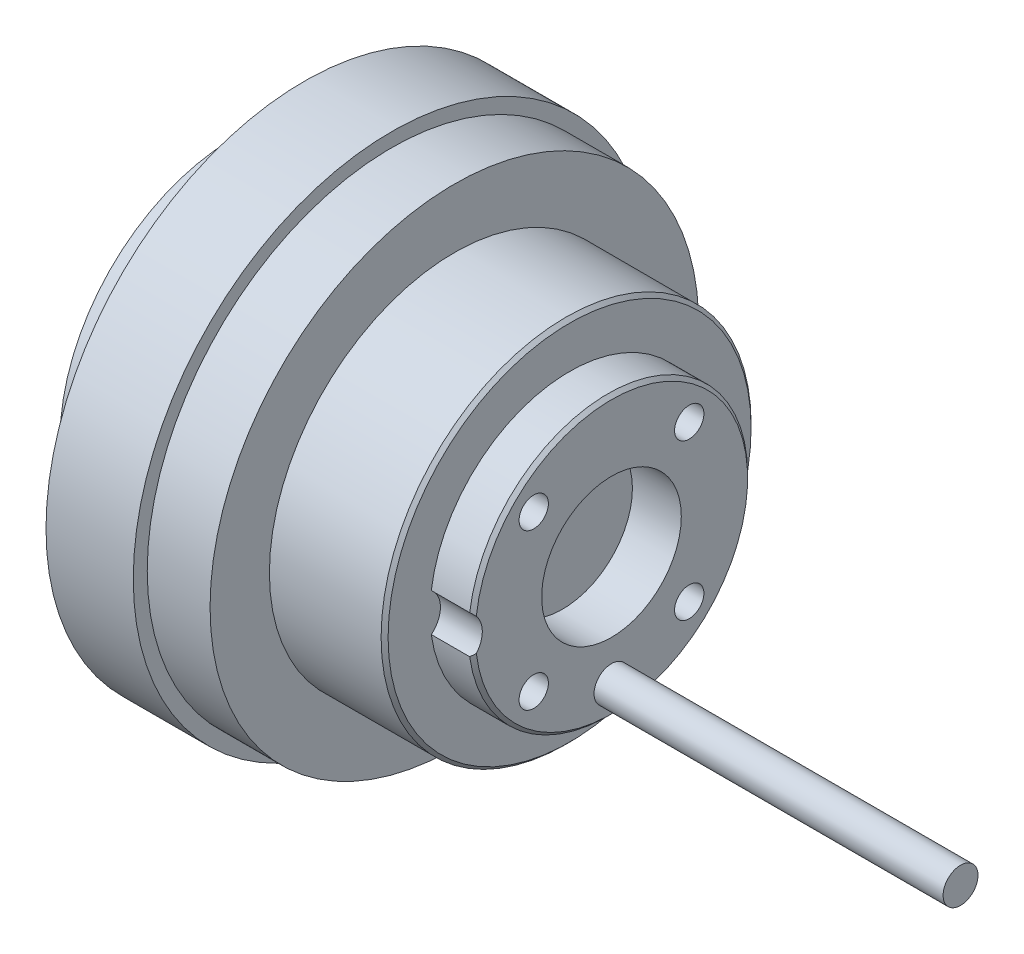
SolidWorks part; units mm, degrees
ref_plane "Front Plane" through (0, 0, 0) normal (0, 0, 1) x (1, 0, 0)
ref_plane "Top  Plane" through (0, 0, 0) normal (0, 1, 0) x (1, 0, 0)
ref_plane "Right  Plane" through (0, 0, 0) normal (1, 0, 0) x (0, 0, -1)
sketch "Sketch2" plane through (0, 0, 0) normal (0, 0, 1) x (1, 0, 0)
  circle A0 centre (0, 0) radius 38
  dimension "D1" = 76
extrude "Base-Extrude" add sketch "Sketch2" along normal mid plane 80
sketch "Sketch3" plane through (0, 0, 0) normal (0, 0, 1) x (1, 0, 0)
  line L0 (46, 40) -> (46, -40)
  line L1 (-75, 16.4833) -> (-75, -26.4833)
  line L2 (0, 0) -> (46, 0) construction
  line L3 (46, 40) -> (39, 40)
  line L4 (46, -40) -> (39, -40)
  line L5 (39, 40) -> (0, 44)
  line L6 (0, 44) -> (-57, 44)
  line L7 (39, -40) -> (0, -54)
  line L8 (0, -54) -> (-57, -54)
  line L9 (-57, 44) -> (-57, -54) construction
  line L10 (-61.3301, -51.5) -> (-74.3301, -28.9833)
  line L11 (-61.3301, 41.5) -> (-74.3301, 18.9833)
  circle A0 centre (0, 0) radius 38 construction
  arc A1 (-57, -54) -> (-61.3301, -51.5) centre (-57, -49) cw
  arc A2 (-57, 44) -> (-61.3301, 41.5) centre (-57, 39) ccw
  arc A3 (-75, -26.4833) -> (-74.3301, -28.9833) centre (-70, -26.4833) ccw
  arc A4 (-74.3301, 18.9833) -> (-75, 16.4833) centre (-70, 16.4833) ccw
  dimension "D4" = 46
  dimension "D7" = 5
  dimension "D10" = 5
  dimension "D1" = 80
  dimension "D2" = 4
  dimension "D3" = 14
  dimension "D5" = 121
  dimension "D6" = 18
  dimension "D8" = 30
  dimension "D9" = 30
  dimension "D11" = 7
extrude "Boss-Extrude1" add sketch "Sketch3" along normal mid plane 68
fillet "Fillet7" radius 2 2 edges at (38, 0, 34) (38, 0, -34)
fillet "Fillet9" radius 4 24 edges at (19.5, 42, -34) (-28.5, 44, -34) (-59.5, 43.3301, -34) (-67.8301, 30.2417, -34) (-74.8296, 17.7774, -34) (-75, -5, -34) (-74.8296, -27.7774, -34) (-67.8301, -40.2417, -34) (-59.5, -53.3301, -34) (-28.5, -54, -34) (19.5, -47, -34) (42.5, -40, -34) (19.5, 42, 34) (-28.5, 44, 34) (-59.5, 43.3301, 34) (-67.8301, 30.2417, 34) (-74.8296, 17.7774, 34) (-75, -5, 34) (-74.8296, -27.7774, 34) (-67.8301, -40.2417, 34) (-59.5, -53.3301, 34) (-28.5, -54, 34) (19.5, -47, 34) (42.5, -40, 34)
sketch "Sketch4" plane through (0, 0, 0) normal (0, 1, 0) x (1, 0, 0)
  line L0 (0, 0) -> (99.4068, 0) construction
  line L2 (40, -34) -> (40, 0)
  line L3 (90, 0) -> (90, -20)
  line L4 (90, 0) -> (40, 0)
  line L5 (90, -20) -> (84, -20)
  line L6 (84, -20) -> (84, -26.5)
  line L7 (84, -26.5) -> (67.5, -26.5)
  line L8 (67.5, -26.5) -> (67.5, -35)
  line L9 (67.5, -35) -> (58.5, -35)
  line L10 (58.5, -35) -> (58.5, -37)
  line L11 (58.5, -37) -> (46, -37)
  line L12 (46, -37) -> (40, -34)
  line L13 (46, -34) -> (39, -34) construction
  line L14 (46, -30) -> (46, 30) construction
  dimension "D1" = 90
  dimension "D2" = 40
  dimension "D3" = 53
  dimension "D4" = 70
  dimension "D5" = 74
  dimension "D6" = 6
  dimension "D7" = 31.5
  dimension "D8" = 22.5
  dimension "D9" = 6
revolve "Boss-Revolve1" add sketch "Sketch4" angle 360 about L0
chamfer ".5 x 45deg" distance 0.5 angle 45 2 edges at (90, 0, 20) (84, 0, 26.5)
sketch "Sketch5" plane through (90, 0, 0) normal (1, 0, 0) x (0, 0, -1)
  circle A0 centre (0, 0) radius 10
  dimension "D1" = 20
extrude "20mm dia x 7mm dp" cut sketch "Sketch5" against normal blind 7
sketch "Sketch6" plane through (90, 0, 0) normal (1, 0, 0) x (0, 0, -1)
  circle A0 centre (0, -15.75) radius 2.5
  circle A1 centre (0, 0) radius 15.75 construction
  dimension "D1" = 5
  dimension "D2" = 31.5
extrude "5mm dia x 7mm dp" cut sketch "Sketch6" against normal blind 7
hole_wizard "M5x0.8 Tapped Hole1" positions "Sketch8" profile "Sketch7" tap size "M5x0.8" standard "Ansi Metric"
sketch "Sketch8" plane through (90, 0, 0) normal (1, 0, 0) x (0, 0, -1)
  line L0 (-11.1369, 11.1369) -> (11.1369, -11.1369) construction
  line L1 (-11.1369, -11.1369) -> (11.1369, 11.1369) construction
  line L4 (-40, 0) -> (-36, 0) construction
  circle A0 centre (0, 0) radius 15.75 construction
  point P0 (-11.1369, 11.1369)
  point P1 (-11.1369, -11.1369)
  point P2 (11.1369, -11.1369)
  point P3 (11.1369, 11.1369)
  dimension "D1" = 31.5
  dimension "D2" = 45
sketch "Sketch7" plane through (90, 11.1369, 11.1369) normal (0, 1, 0) x (0, 0, -1)
  line L0 (0, 0) -> (0, 12.6618)
  line L1 (0, 12.6618) -> (2.1, 11.4)
  line L2 (2.1, 11.4) -> (2.1, 0)
  line L5 (2.1, 0) -> (0, 0)
  line L10 (0, 12.6618) -> (-2.1, 11.4) construction
  line L11 (0, -6.35) -> (0, 107.95) construction
  dimension "Hole Dia." = 4.2
  dimension "Hole Depth" = 11.4
  dimension "Drill Angle" = 118
sketch "Sketch9" plane through (90, 0, 0) normal (1, 0, 0) x (0, 0, -1)
  circle A0 centre (0, 0) radius 22 construction
  arc A1 (-19.8125, -2.7322) -> (-19.8125, 2.7322) centre (-22, 0) ccw
  circle A2 centre (0, 0) radius 20 construction
  arc A3 (-19.8125, 2.7322) -> (-19.8125, -2.7322) centre (0, 0) ccw
  dimension "D1" = 44
  dimension "D2" = 3.5
extrude "Cut-Extrude3" cut sketch "Sketch9" against normal up to surface (6 mm away)
sketch "Sketch10" plane through (46, 0, 0) normal (1, 0, 0) x (0, 0, -1)
  line L1 (42.4154, 51.6478) -> (-44.5292, 51.6478)
  line L2 (42.4154, 51.6478) -> (42.4154, -62.2115)
  line L3 (42.4154, -62.2115) -> (-44.5292, -62.2115)
  line L4 (-44.5292, 51.6478) -> (-44.5292, -62.2115)
extrude "cutoff" cut sketch "Sketch10" against normal through all
sketch "Sketch11" plane through (90, 0, 0) normal (1, 0, 0) x (0, 0, -1)
  circle A2 centre (0, -15.75) radius 2.5 construction
  circle A3 centre (0, -15.75) radius 2.5
extrude "Extrude1" add sketch "Sketch11" along normal blind 50 and the other way blind 10
sketch "Sketch12" plane through (46, 0, 0) normal (-1, 0, 0) x (0, 0, 1)
  circle A0 centre (0, 0) radius 25
  dimension "D1" = 50
extrude "Extrude2" add sketch "Sketch12" along normal blind 10
